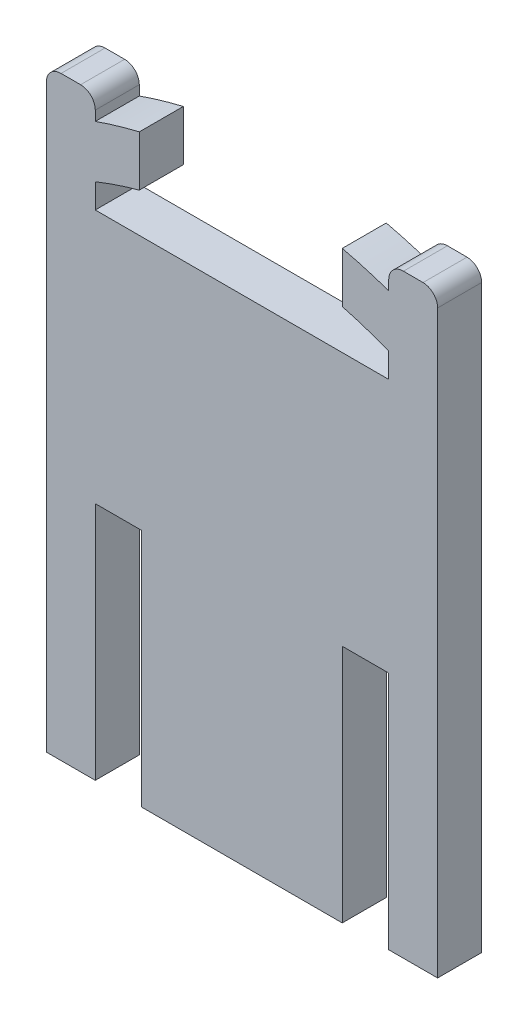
SolidWorks part; units mm, degrees
ref_plane "Plan de face" through (0, 0, 0) normal (0, 0, 1) x (1, 0, 0)
ref_plane "Plan de dessus" through (0, 0, 0) normal (0, 1, 0) x (1, 0, 0)
ref_plane "Plan de droite" through (0, 0, 0) normal (1, 0, 0) x (0, 0, -1)
sketch "Esquisse2" plane through (0, 0, 0) normal (0, 0, 1) x (1, 0, 0)
  line L0 (-30, 55) -> (-21, 55) construction
  line L1 (-30, 9) -> (-30, 58)
  line L3 (30, 110) -> (30, 30) construction
  line L4 (-30, 58) -> (-20.5, 58)
  line L5 (-20.5, 58) -> (-20.5, 9)
  line L6 (-30, 9) -> (-40, 9)
  line L8 (-40, 9) -> (-40, 127.6832)
  line L9 (-37, 130.6832) -> (-33, 130.6832)
  line L10 (-30, 127.6832) -> (-30, 125.6832)
  line L11 (-30, 110) -> (30, 110)
  line L12 (0, 0) -> (0, 110) construction
  line L13 (30, 127.671) -> (30, 125.6832)
  line L14 (37.0122, 130.6547) -> (33.0122, 130.671)
  line L15 (40, 9) -> (40, 127.6547)
  line L18 (20.5, 58) -> (20.5, 9)
  line L19 (30, 58) -> (20.5, 58)
  line L21 (30, 9) -> (30, 58)
  line L22 (-21, 118.0146) -> (-21, 128.3324)
  line L23 (20.5, 128.4502) -> (20.5, 118.1481)
  line L24 (-21, 110) -> (-21, 30) construction
  line L25 (-30, 115) -> (-30, 110)
  line L26 (30, 115) -> (30, 110)
  line L27 (20.5, 9) -> (-20.5, 9)
  line L28 (30, 9) -> (40, 9)
  arc A0 (30, 125.6832) -> (20.5, 128.4502) centre (0, 40.3774) ccw
  arc A1 (30, 115) -> (20.5, 118.1481) centre (0, 40.3774) ccw
  arc A2 (26.6824, 116.2495) -> (-26.6824, 116.2495) centre (0, 40.3774) ccw construction
  arc A3 (-21, 118.0146) -> (-30, 115) centre (0, 40.3774) ccw
  arc A4 (-21, 128.3324) -> (-30, 125.6832) centre (0, 40.3774) ccw
  arc A5 (37.0122, 130.6547) -> (40, 127.6547) centre (37, 127.6547) cw
  arc A6 (30, 125.6832) -> (-30, 125.6832) centre (0, 40.3774) ccw construction
  arc A7 (30, 127.671) -> (33.0122, 130.671) centre (33, 127.671) cw
  arc A8 (-33, 130.6832) -> (-30, 127.6832) centre (-33, 127.6832) cw
  arc A9 (-40, 127.6832) -> (-37, 130.6832) centre (-37, 127.6832) cw
  point P32 (40, 130.6832)
  point P36 (30, 130.6832)
  point P39 (-30, 130.6832)
  point P42 (-40, 130.6832)
  dimension "D3" = 10
  dimension "D4" = 5
  dimension "D6" = 3
  dimension "D1" = 9
  dimension "D2" = 9.5
  dimension "D5" = 10
  dimension "D7" = 9.5
  dimension "D8" = 10
  dimension "D9" = 3
  dimension "D10" = 5
extrude "Boss.-Extru.1" add sketch "Esquisse2" along normal blind 9
